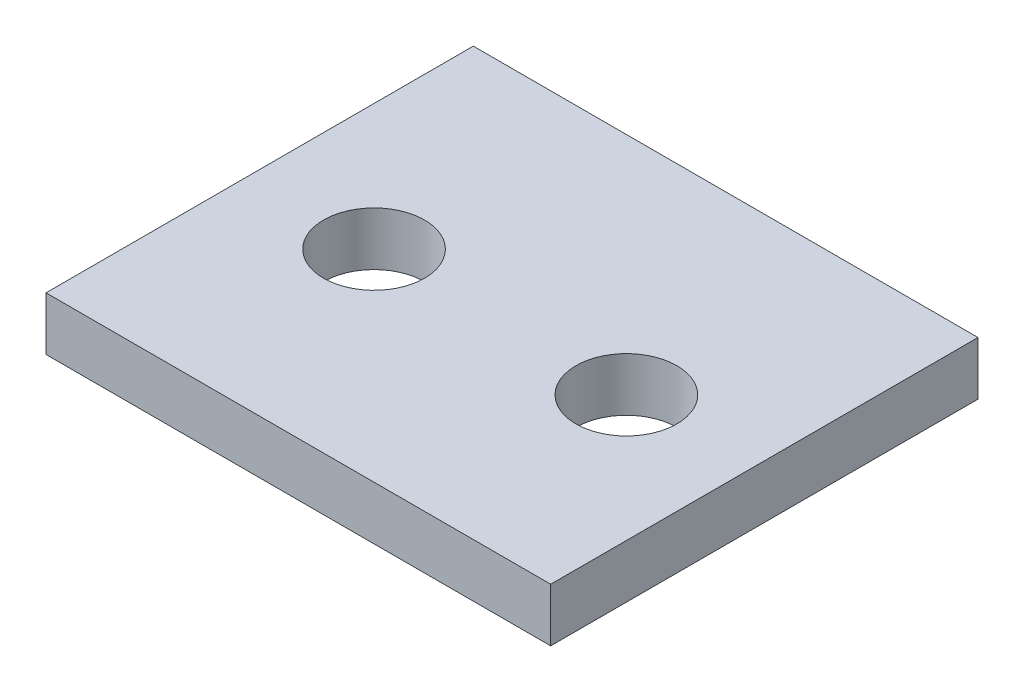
SolidWorks part; units mm, degrees
ref_plane "Front Plane" through (0, 0, 0) normal (0, 0, 1) x (1, 0, 0)
ref_plane "Top Plane" through (0, 0, 0) normal (0, 1, 0) x (1, 0, 0)
ref_plane "Right Plane" through (0, 0, 0) normal (1, 0, 0) x (0, 0, -1)
sketch "Sketch1" plane through (0, 0, 0) normal (0, 1, 0) x (1, 0, 0)
  line L0 (0, 0) -> (0, 17.0967) construction
  line L1 (-15, 12.7) -> (15, 12.7)
  line L2 (-15, 12.7) -> (-15, -12.7)
  line L3 (-15, -12.7) -> (15, -12.7)
  line L4 (15, 12.7) -> (15, -12.7)
  line L5 (-15, 12.7) -> (15, -12.7) construction
  line L6 (-15, -12.7) -> (15, 12.7) construction
  circle A0 centre (-7.5, -0.7) radius 3
  circle A1 centre (7.5, -0.7) radius 3
  point P0 (0, 0)
  dimension "D3" = 6
  dimension "D4" = 7.5
  dimension "D1" = 30
  dimension "D2" = 25.4
  dimension "D5" = 12
extrude "Extrude1" add sketch "Sketch1" along normal blind 3.175
